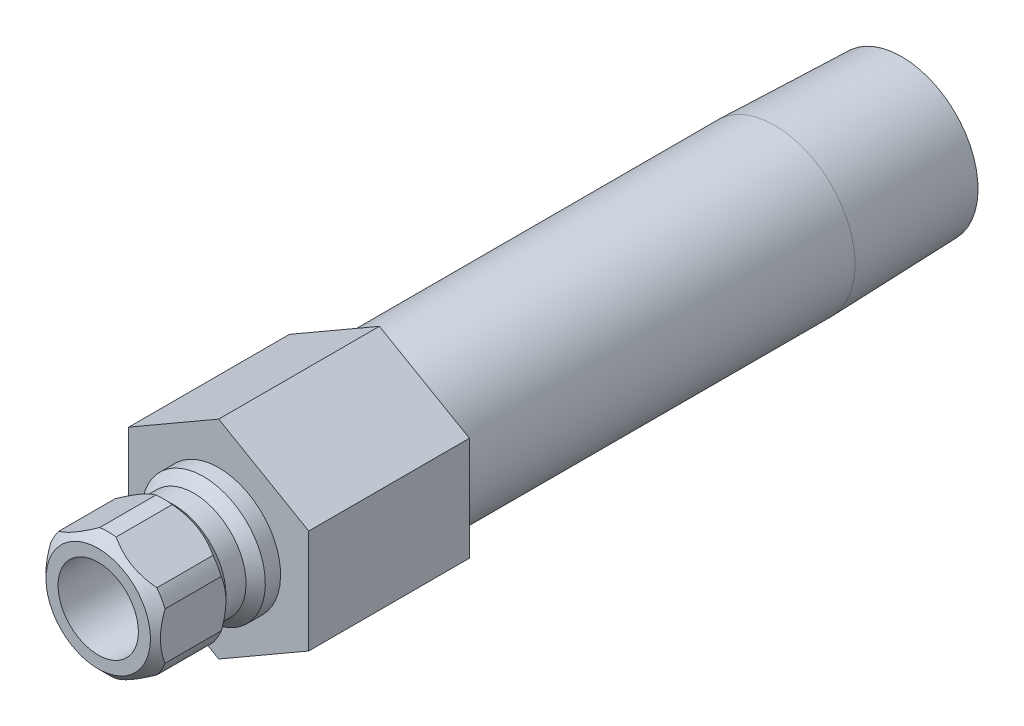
SolidWorks part; units mm, degrees
ref_plane "Front Plane" through (0, 0, 0) normal (0, 0, 1) x (1, 0, 0)
ref_plane "Top Plane" through (0, 0, 0) normal (0, 1, 0) x (1, 0, 0)
ref_plane "Right Plane" through (0, 0, 0) normal (1, 0, 0) x (0, 0, -1)
sketch "Sketch1" plane through (0, 0, 0) normal (1, 0, 0) x (0, 0, -1)
  line L0 (0, 0) -> (-12.7, 0) construction
  line L1 (-9.525, 3.175) -> (-9.525, 4.1275)
  line L2 (-3.556, 4.1275) -> (-3.556, 0) construction
  line L3 (-8.763, 4.8895) -> (-4.318, 4.8895)
  line L4 (0, 6.35) -> (0, 0) construction
  line L5 (-3.556, 4.1275) -> (-1.9685, 4.1275)
  line L6 (-1.2065, 4.8895) -> (0, 4.8895)
  line L7 (0, 4.8895) -> (0, 6.35)
  line L8 (-3.556, 4.1275) -> (-4.318, 4.8895)
  line L9 (-1.9685, 4.1275) -> (-1.2065, 4.8895)
  line L10 (-9.525, 4.1275) -> (-8.763, 4.8895)
  line L11 (12.7, 4.6228) -> (53.975, 4.6228)
  line L12 (0, 6.35) -> (43.942, 6.35)
  line L13 (43.942, 6.35) -> (53.975, 6.0365)
  line L14 (53.975, 6.0365) -> (53.975, 4.6228)
  line L15 (0, 0) -> (12.7, 0) construction
  line L16 (12.7, 0) -> (12.7, 4.8895) construction
  line L17 (12.7, 4.8895) -> (0, 4.8895) construction
  line L18 (12.7, 4.6228) -> (12.7, 3.175)
  line L19 (12.7, 3.175) -> (-9.525, 3.175)
  dimension "D1" = 9.525
  dimension "D2" = 1.5875
  dimension "D3" = 0.762
  dimension "D4" = 45
  dimension "D5" = 5.969
  dimension "D6" = 45
  dimension "D7" = 1.79
  dimension "D8" = 10.033
  dimension "D9" = 63.5
  dimension "D10" = 3.175
  dimension "D11" = 22.225
  dimension "D12" = 9.2456
  dimension "D13" = 6.35
  dimension "D14" = 9.779
  dimension "D15" = 12.7
revolve "Revolve1" add sketch "Sketch1" angle 360 about L0
sketch "Sketch2" plane through (0, 0, 0) normal (0, 0, 1) x (1, 0, 0)
  line L1 (-7.112, 4.1061) -> (-7.112, -4.1061)
  line L2 (-7.112, -4.1061) -> (0, -8.2122)
  line L3 (0, -8.2122) -> (7.112, -4.1061)
  line L4 (7.112, -4.1061) -> (7.112, 4.1061)
  line L5 (7.112, 4.1061) -> (0, 8.2122)
  line L6 (0, 8.2122) -> (-7.112, 4.1061)
  circle A0 centre (0, 0) radius 7.112 construction
  circle A1 centre (0, 0) radius 3.175 construction
  circle A2 centre (0, 0) radius 3.175
  dimension "D1" = 14.224
extrude "Boss-Extrude1" add sketch "Sketch2" against normal up to vertex (12.7 mm away) from vertex at 0
sketch "Sketch3" plane through (0, 0, 0) normal (0, 0, 1) x (1, 0, 0)
  line L1 (4.5212, -2.6103) -> (4.5212, 2.6103)
  line L2 (4.5212, 2.6103) -> (0, 5.2206)
  line L3 (0, 5.2206) -> (-4.5212, 2.6103)
  line L4 (-4.5212, 2.6103) -> (-4.5212, -2.6103)
  line L5 (-4.5212, -2.6103) -> (0, -5.2206)
  line L6 (0, -5.2206) -> (4.5212, -2.6103)
  circle A0 centre (0, 0) radius 4.5212 construction
  dimension "D1" = 9.0424
extrude "Cut-Extrude1" cut sketch "Sketch3" along normal through all from vertex at 3.556 flip side to cut
